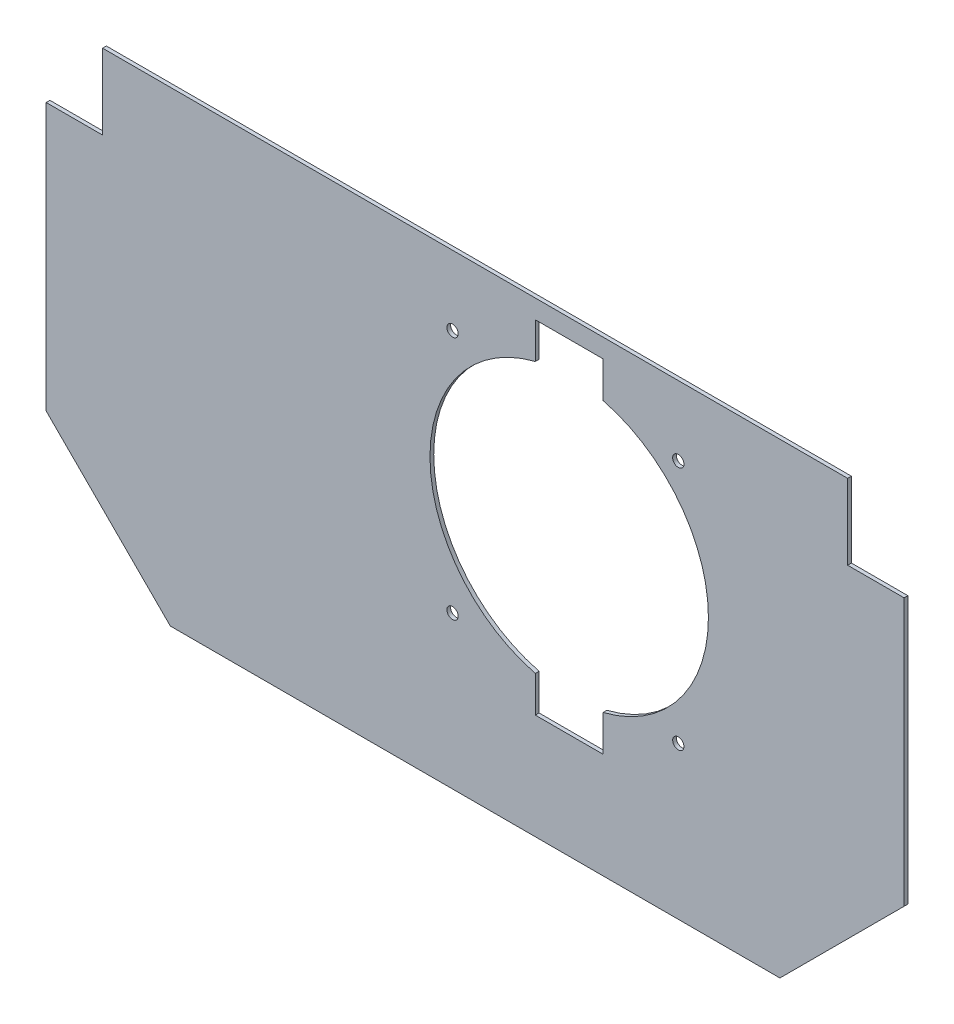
SolidWorks part; units mm, degrees
ref_plane "Front" through (0, 0, 0) normal (0, 0, 1) x (1, 0, 0)
ref_plane "Top" through (0, 0, 0) normal (0, 1, 0) x (1, 0, 0)
ref_plane "Right" through (0, 0, 0) normal (1, 0, 0) x (0, 0, -1)
sketch "草图1" plane through (0, 0, 0) normal (0, 0, 1) x (1, 0, 0)
  line L0 (-73.8347, 58.4592) -> (-73.8347, 38.4592)
  line L5 (-73.8347, 38.4592) -> (-88.8347, 38.4592)
  line L6 (124.1653, 38.4592) -> (139.1653, 38.4592)
  line L7 (124.1653, 58.4592) -> (124.1653, 38.4592)
  line L12 (-88.8347, -32.5408) -> (-55.8347, -65.5408)
  line L13 (106.1653, -65.5408) -> (139.1653, -32.5408)
  line L14 (-73.8347, 58.4592) -> (124.1653, 58.4592)
  line L15 (-55.8347, -65.5408) -> (106.1653, -65.5408)
  line L16 (139.1653, -32.5408) -> (139.1653, 38.4592)
  line L17 (-88.8347, -32.5408) -> (-88.8347, 38.4592)
  line L19 (41.1653, 53.4592) -> (59.1653, 53.4592)
  line L21 (41.1653, -37.5408) -> (59.1653, -37.5408)
  line L23 (41.1653, 53.4592) -> (41.1653, 43.8479)
  line L24 (59.1653, 53.4592) -> (59.1653, 43.8479)
  line L25 (41.1653, -37.5408) -> (41.1653, -27.9295)
  line L26 (59.1653, -37.5408) -> (59.1653, -27.9295)
  line L27 (79.1653, 39.9592) -> (79.1653, -25.0408) construction
  arc A1 (41.1653, -27.9295) -> (41.1653, 43.8479) centre (50.1653, 7.9592) cw
  arc A2 (59.1653, -27.9295) -> (59.1653, 43.8479) centre (50.1653, 7.9592) ccw
  circle A3 centre (79.1653, 39.9592) radius 1.5
  circle A4 centre (19.1653, 39.9592) radius 1.5
  circle A5 centre (19.1653, -25.0408) radius 1.5
  circle A6 centre (79.1653, -25.0408) radius 1.5
  dimension "D7" = 18.5
  dimension "D1" = 18
  dimension "D2" = 91
  dimension "D3" = 20
  dimension "D4" = 15
  dimension "D5" = 15
  dimension "D6" = 71
  dimension "D8" = 60
  dimension "D9" = 89
  dimension "D12" = 65
  dimension "D13" = 71
  dimension "D10" = 2
  dimension "D11" = 2
extrude "凸台-拉伸1" add sketch "草图1" along normal blind 1
